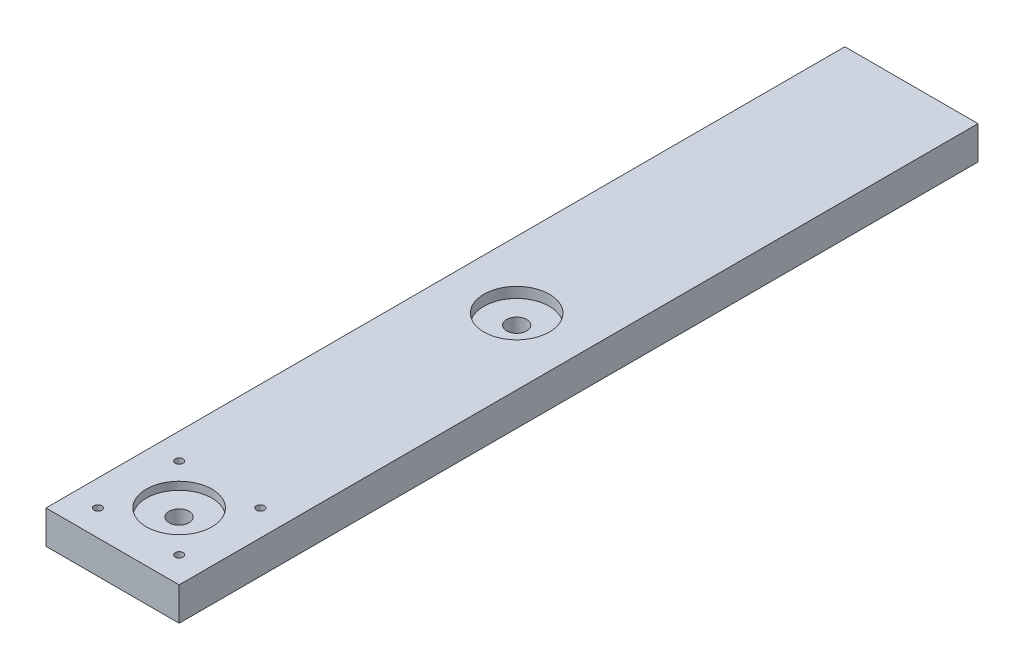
SolidWorks part; units mm, degrees
ref_plane "Front Plane" through (0, 0, 0) normal (0, 0, 1) x (1, 0, 0)
ref_plane "Top Plane" through (0, 0, 0) normal (0, 1, 0) x (1, 0, 0)
ref_plane "Right Plane" through (0, 0, 0) normal (1, 0, 0) x (0, 0, -1)
sketch "Sketch2" plane through (0, 0, 0) normal (0, 1, 0) x (-1, 0, 0)
  circle A0 centre (0, 0) radius 5.08
  dimension "D1" = 10.16
extrude "Boss-Extrude2" add sketch "Sketch2" along normal blind 41.91
sketch "Sketch3" plane through (0, 0, 0) normal (0, 0, 1) x (1, 0, 0)
  line L1 (0, 0) -> (0, 7.62) construction
  line L4 (0, 7.62) -> (0, 13.97)
  line L7 (0, 7.62) -> (-8.89, 7.62)
  line L8 (-8.89, 7.62) -> (-8.89, 13.97)
  line L9 (-8.89, 13.97) -> (0, 13.97)
  dimension "D1" = 6.35
  dimension "D2" = 8.89
  dimension "D3" = 7.62
sketch "Sketch7" plane through (0, 0, 0) normal (0, -1, 0) x (1, 0, 0)
  line L0 (0.577, -2.5995) -> (2.6291, -0.2454)
  circle A1 centre (-1.9453, 1.6968) radius 0.0101
  circle A3 centre (-0.0417, 0.0113) radius 2.6831
sketch "Sketch8" plane through (0, 41.91, 0) normal (0, 1, 0) x (1, 0, 0)
  line L1 (-25.4, 23.6223) -> (25.4, 23.6223)
  line L2 (-25.4, 23.6223) -> (-25.4, -154.1777)
  line L3 (-25.4, -154.1777) -> (25.4, -154.1777)
  line L4 (25.4, 23.6223) -> (25.4, -154.1777)
  point P4 (0, 23.6223)
  dimension "D1" = 50.8
  dimension "D2" = 177.8
extrude "Boss-Extrude3" add sketch "Sketch8" along normal blind 12.7
sketch "Sketch9" plane through (0, 41.91, 0) normal (0, -1, 0) x (1, 0, 0)
  line L0 (-25.4, 154.1777) -> (25.4, 154.1777) construction
  line L1 (0.0567, 138.8033) -> (0.1999, 138.8102)
  circle A0 centre (0, 141.4777) radius 5.08
  circle A1 centre (-1.6961, 107.3391) radius 0.0101
  circle A3 centre (0, 141.4777) radius 2.675
  dimension "D1" = 10.16
  dimension "D3" = 5.35
  dimension "D2" = 12.7
sketch "Sketch11" plane through (0, 54.61, 0) normal (0, 1, 0) x (1, 0, 0)
  line L1 (20.7996, -20.7996) -> (-20.7996, -20.7996)
  line L2 (20.7996, -20.7996) -> (20.7996, 20.7996)
  line L3 (20.7996, 20.7996) -> (-20.7996, 20.7996)
  line L4 (-20.7996, -20.7996) -> (-20.7996, 20.7996)
  line L5 (-15.5, -15.5) -> (15.5, 15.5) construction
  circle A1 centre (0, 0) radius 12.5
  circle A2 centre (-15.5, -15.5) radius 1.5 construction
  circle A3 centre (-15.5, 15.5) radius 1.5 construction
  circle A4 centre (15.5, 15.5) radius 1.5 construction
  circle A5 centre (15.5, -15.5) radius 1.5 construction
  point P5 (20.7996, 0)
  point P6 (0, 20.7996)
  point P18 (0, 0)
  dimension "D1" = 3
  dimension "D4" = 25
  dimension "D2" = 31
  dimension "D3" = 31
sketch "Sketch12" plane through (0, 54.61, 0) normal (0, 1, 0) x (1, 0, 0)
  line L0 (0.577, 2.5995) -> (2.6291, 0.2454)
  circle A0 centre (0, 0) radius 2.6399
sketch "Sketch14" plane through (0, 41.91, 0) normal (0, -1, 0) x (1, 0, 0)
  line L0 (25.4, 154.1777) -> (25.4, -23.6223) construction
  line L1 (-25.4, 154.1777) -> (25.4, 154.1777)
  line L2 (-25.4, 154.1777) -> (-25.4, 103.3777)
  line L3 (-25.4, 103.3777) -> (25.4, 103.3777)
  line L4 (25.4, 154.1777) -> (25.4, 103.3777)
  line L6 (-15.5, 113.2777) -> (15.5, 144.2777) construction
  circle A1 centre (0, 128.7777) radius 3.81
  circle A4 centre (15.5, 144.2777) radius 1.5
  circle A5 centre (15.5, 113.2777) radius 1.5
  circle A6 centre (-15.5, 113.2777) radius 1.5
  circle A7 centre (-15.5, 144.2777) radius 1.5
  dimension "D1" = 3
  dimension "D4" = 7.62
  dimension "D2" = 31
  dimension "D3" = 31
extrude "Cut-Extrude5" cut sketch "Sketch14" against normal blind 30.94
sketch "Sketch18" plane through (0, 54.61, 0) normal (0, 1, 0) x (1, 0, 0)
  circle A0 centre (0, -128.7777) radius 12.5
  circle A2 centre (0, -128.7777) radius 3.81 construction
  dimension "D1" = 25
extrude "Cut-Extrude6" cut sketch "Sketch18" against normal blind 3
sketch "Sketch19" plane through (-25.4, 0, 0) normal (-1, 0, 0) x (0, 0, 1)
  line L0 (-23.6223, 41.91) -> (154.1777, 41.91) construction
  line L1 (-22.415, 41.91) -> (20.1895, 41.91)
  line L2 (-22.415, 41.91) -> (-22.415, -5.0783)
  line L3 (-22.415, -5.0783) -> (20.1895, -5.0783)
  line L4 (20.1895, 41.91) -> (20.1895, -5.0783)
extrude "Cut-Extrude7" cut sketch "Sketch19" against normal blind 85.804
sketch "Sketch20" plane through (0, 41.91, 0) normal (0, -1, 0) x (1, 0, 0)
  circle A0 centre (0, 0) radius 3.81
  dimension "D1" = 7.62
extrude "Cut-Extrude8" cut sketch "Sketch20" against normal through all
sketch "Sketch21" plane through (0, 54.61, 0) normal (0, 1, 0) x (1, 0, 0)
  circle A0 centre (0, 0) radius 12.5
extrude "Cut-Extrude9" cut sketch "Sketch21" against normal blind 4
sketch "Sketch23" plane through (0, 0, -23.6223) normal (0, 0, -1) x (-1, 0, 0)
  line L1 (-25.4, 41.91) -> (25.4, 41.91)
  line L2 (-25.4, 41.91) -> (-25.4, 54.61)
  line L3 (-25.4, 54.61) -> (25.4, 54.61)
  line L4 (25.4, 41.91) -> (25.4, 54.61)
extrude "Boss-Extrude4" add sketch "Sketch23" along normal blind 127
